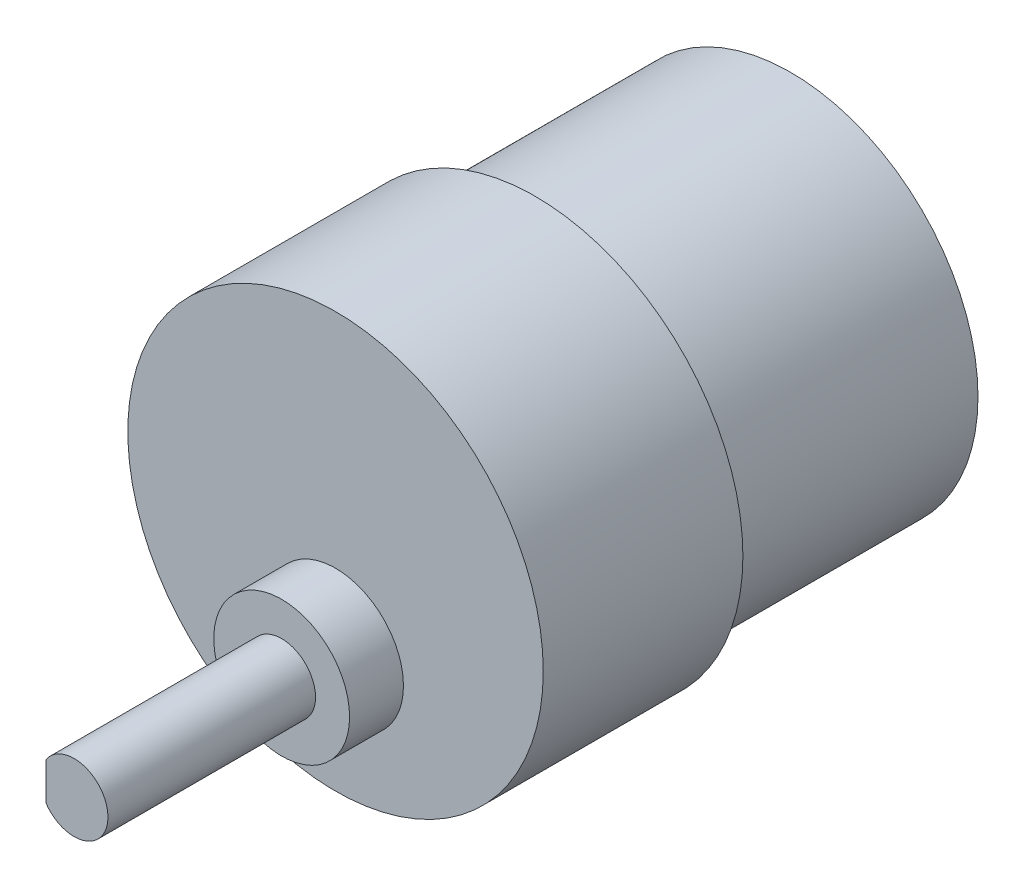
SolidWorks part; units mm, degrees
ref_plane "Front Plane" through (0, 0, 0) normal (0, 0, 1) x (1, 0, 0)
ref_plane "Top Plane" through (0, 0, 0) normal (0, 1, 0) x (1, 0, 0)
ref_plane "Right Plane" through (0, 0, 0) normal (1, 0, 0) x (0, 0, -1)
sketch "Sketch1" plane through (0, 0, 0) normal (0, 0, 1) x (1, 0, 0)
  circle A0 centre (0, 0) radius 16.51
  dimension "D1" = 33.02
extrude "Boss-Extrude1" add sketch "Sketch1" along normal blind 22.5298
sketch "Sketch2" plane through (0, 0, 22.5298) normal (0, 0, 1) x (1, 0, 0)
  circle A0 centre (0, 0) radius 18.3134
  dimension "D1" = 36.6268
extrude "Boss-Extrude2" add sketch "Sketch2" along normal blind 17.6022
sketch "Sketch3" plane through (0, 0, 40.132) normal (0, 0, 1) x (1, 0, 0)
  line L0 (0, 0) -> (0, -1.2827) construction
  line L1 (0, -1.2827) -> (0, -18.3134) construction
  circle A0 centre (0, -7.2708) radius 5.988
  circle A3 centre (0, 0) radius 18.3134 construction
  point P5 (-7.8834, -4.4224)
  dimension "D1" = 11.9761
  dimension "D2" = 17.0307
extrude "Boss-Extrude3" add sketch "Sketch3" along normal blind 4.7498
sketch "Sketch4" plane through (0, 0, 44.8818) normal (0, 0, 1) x (1, 0, 0)
  circle A0 centre (0, -7.2708) radius 2.9845
  circle A3 centre (0, -7.2708) radius 5.988 construction
  dimension "D1" = 5.969
extrude "Boss-Extrude4" add sketch "Sketch4" along normal blind 18.3007
sketch "Sketch5" plane through (0, 0, 63.1825) normal (0, 0, 1) x (1, 0, 0)
  line L0 (2.9845, -7.2708) -> (2.9845, -3.1726) construction
  line L1 (-2.4765, -8.9363) -> (-5.3297, -8.9363)
  line L2 (-2.4765, -8.9363) -> (-2.4765, -5.6052)
  line L3 (-2.4765, -5.6052) -> (-5.3297, -5.6052)
  line L4 (-5.3297, -8.9363) -> (-5.3297, -5.6052)
  circle A0 centre (0, -7.2708) radius 2.9845 construction
  circle A1 centre (0, -7.2708) radius 2.9845 construction
  dimension "D1" = 5.461
extrude "Cut-Extrude1" cut sketch "Sketch5" against normal blind 12.192
